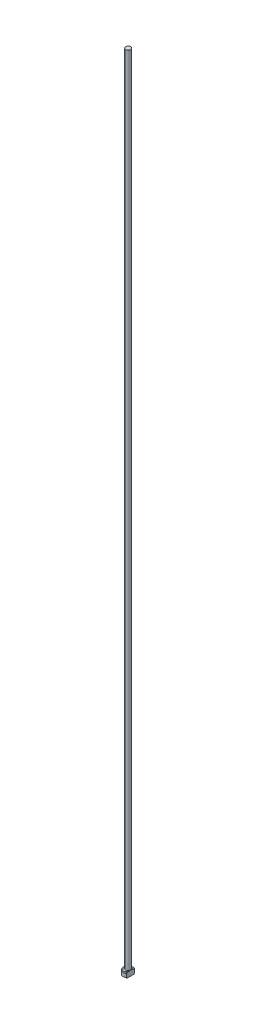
SolidWorks part; units mm, degrees
ref_plane "Front Plane" through (0, 0, 0) normal (0, 0, 1) x (1, 0, 0)
ref_plane "Top Plane" through (0, 0, 0) normal (0, 1, 0) x (1, 0, 0)
ref_plane "Right Plane" through (0, 0, 0) normal (1, 0, 0) x (0, 0, -1)
sketch "Sketch1" plane through (0, 0, 0) normal (0, 0, 1) x (1, 0, 0)
  line L0 (0, 259.9588) -> (0, -15.1925) construction
  line L1 (0, 0) -> (-1.5, 0)
  line L2 (-1.5, 0) -> (-1.5, 1.5)
  line L3 (-1.5, 1.5) -> (-0.8, 1.5)
  line L4 (-0.8, 1.5) -> (-0.8, 250)
  line L5 (-0.8, 250) -> (0, 250)
  line L6 (0, 250) -> (0, 0)
  dimension "L" = 250
  dimension "H" = 3
  dimension "T" = 1.5
  dimension "D" = 1.6
revolve "Revolve1" add sketch "Sketch1" angle 360 about L0
chamfer "Chamfer1" distance 0.2 angle 45 2 edges at (0, 1.5, 1.5) (0, 0, 1.5)
fillet "Fillet1" radius 0.2 1 edges at (0, 1.5, 0.8)
sketch "Sketch2" plane through (0, 0, 0) normal (0, 1, 0) x (1, 0, 0)
  line L0 (0.8, 1.2689) -> (0.8, -1.2689)
  circle A0 centre (0, 0) radius 1.5 construction
  arc A1 (0.8, -1.2689) -> (0.8, 1.2689) centre (0, 0) ccw
  circle A2 centre (0, 0) radius 0.8 construction
extrude "KEY" cut sketch "Sketch2" along normal through all
